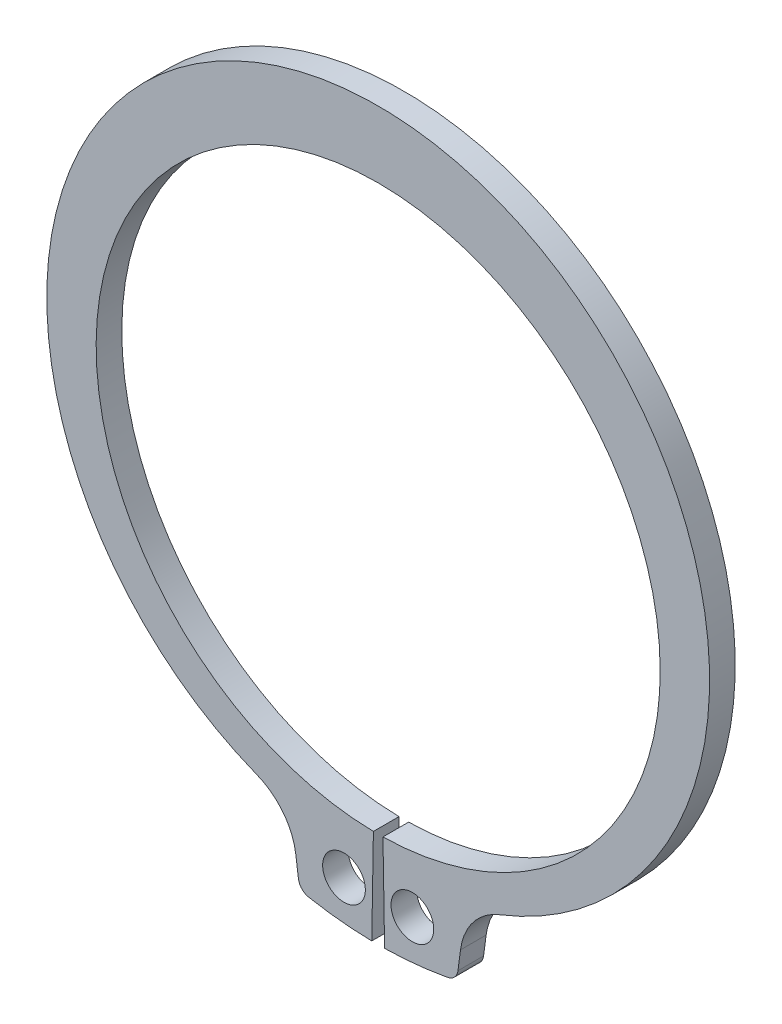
SolidWorks part; units mm, degrees
ref_plane "Plane1" through (0, 0, 0) normal (0, 0, 1) x (1, 0, 0)
ref_plane "Plane2" through (0, 0, 0) normal (0, 1, 0) x (1, 0, 0)
ref_plane "Plane3" through (0, 0, 0) normal (1, 0, 0) x (0, 0, -1)
sketch "Clipboard" plane through (0, 0, 0) normal (0, 0, 1) x (1, 0, 0)
  line L0 (0, 0) -> (3.9, 0)
  line L1 (0, 0) -> (0, 1.95)
  line L2 (0, 0) -> (0, -5.6)
  circle A0 centre (0, 0) radius 1.25
  circle A1 centre (0, 0) radius 17.5
  dimension "HoleDia" = 2.5
  dimension "ShaftDia" = 35
  dimension "LargeSection" = 3.9
  dimension "SmallSection" = 1.95
  dimension "LugSection" = 5.6
sketch "BodySke" plane through (0, 0, 0) normal (0, 0, 1) x (1, 0, 0)
  line L0 (-1.5431, 0) -> (1.5431, 0) construction
  line L1 (0, 0) -> (0, 20.4) construction
  line L2 (0.28, -16.4976) -> (0.375, -22.0968)
  line L3 (-0.28, -16.4976) -> (-0.375, -22.0968)
  line L4 (0, 0) -> (8.4342, -20.4273) construction
  line L5 (0, 0) -> (-8.4342, -20.4273) construction
  line L7 (4.816, -19.9509) -> (4.6668, -21.0843)
  line L8 (-4.816, -19.9509) -> (-4.6668, -21.0843)
  circle A0 centre (0, 0) radius 16.5 construction
  arc A1 (0.28, -16.4976) -> (-0.28, -16.4976) centre (0, 0) ccw
  arc A2 (7.0412, -17.0535) -> (-7.0412, -17.0535) centre (0, 1.0114) ccw construction
  arc A3 (0.375, -22.0968) -> (4.0611, -21.7237) centre (0, 0) ccw
  arc A4 (7.0982, -17.0313) -> (4.816, -19.9509) centre (8.4342, -20.4273) ccw
  arc A5 (-4.816, -19.9509) -> (-7.0982, -17.0313) centre (-8.4342, -20.4273) ccw
  arc A6 (-4.0611, -21.7237) -> (-0.375, -22.0968) centre (0, 0) ccw
  arc A7 (7.0982, -17.0313) -> (-7.0982, -17.0313) centre (0, 1.0114) ccw
  arc A8 (-4.9176, -19.1796) -> (4.9176, -19.1796) centre (0, 0) ccw construction
  circle A9 centre (2, -19.6987) radius 1.25
  circle A10 centre (-2, -19.6987) radius 1.25
  arc A11 (4.6668, -21.0843) -> (4.0611, -21.7237) centre (3.9232, -20.9864) cw
  arc A12 (-4.6668, -21.0843) -> (-4.0611, -21.7237) centre (-3.9232, -20.9864) ccw
  point P28 (4.5968, -21.6167)
  point P31 (-4.5968, -21.6167)
  dimension "GrooveDia" = 33
  dimension "D3" = 0.75
  dimension "LugRad" = 22.1
  dimension "HoleOffsetRad" = 19.8
  dimension "HoleDia" = 2.5
  dimension "D2" = 15
  dimension "LargeRad" = 20.4
  dimension "SmallRad" = 18.45
  dimension "Gap" = 0.75
  dimension "SmallAngle" = 44.87
  dimension "HoleSpacing" = 4
extrude "Body" add sketch "BodySke" against normal blind 1.5
sketch "NotSke" plane through (0, 0, 0) normal (0, 0, 1) x (1, 0, 0)
  line L0 (2, -18.4487) -> (2, -20.9487)
  line L1 (2, -20.9487) -> (-2, -20.9487)
  line L2 (-2, -20.9487) -> (-2, -18.4487)
  line L3 (-2, -18.4487) -> (2, -18.4487)
  circle A0 centre (2, -19.6987) radius 1.25 construction
  circle A1 centre (-2, -19.6987) radius 1.25 construction
extrude "Notch" [suppressed] cut sketch "NotSke" against normal through all
sketch "UnlSke" plane through (0, 0, 0) normal (0, 0, 1) x (1, 0, 0)
  line L0 (-3.6159, -21.8022) -> (-2.6997, -16.2776)
  line L1 (3.6159, -21.8022) -> (2.6997, -16.2776)
  arc A0 (2.6997, -16.2776) -> (-2.6997, -16.2776) centre (0, 0) ccw
  arc A1 (3.6159, -21.8022) -> (-3.6159, -21.8022) centre (0, 0) ccw
  arc A2 (0.375, -22.0968) -> (4.0611, -21.7237) centre (0, 0) ccw construction
  arc A3 (0.28, -16.4976) -> (-0.28, -16.4976) centre (0, 0) ccw construction
  circle A4 centre (-2, -19.6987) radius 1.25 construction
  circle A5 centre (2, -19.6987) radius 1.25 construction
extrude "Unlug" [suppressed] add sketch "UnlSke" against normal through all
equation "' \"ShaftDia@Clipboard\" = 3"
equation "' \"Thickness@Body\" = 0.4"
equation "' \"GrooveDia@BodySke\" = 2.8"
equation "' \"LugSection@Clipboard\" = 1.9"
equation "' \"LargeSection@Clipboard\" = 0.8"
equation "' \"HoleDia@Clipboard\" = 1.0"
equation "' \"ShaftDia@Clipboard\" = 10"
equation "' \"Thickness@Body\" = 1.0"
equation "' \"GrooveDia@BodySke\" = 9.6"
equation "' \"LugSection@Clipboard\" = 3.3"
equation "' \"LargeSection@Clipboard\" = 1.8"
equation "' \"HoleDia@Clipboard\" = 1.5"
equation "\"SmallSection@Clipboard\" = \"LargeSection@Clipboard\" * 0.5"
equation "\"Gap@BodySke\" =  \"Thickness@Body\" / 2"
equation "\"LargeRad@BodySke\" =  \"GrooveDia@BodySke\" / 2 +  \"LargeSection@Clipboard\""
equation "\"SmallRad@BodySke\" =  \"GrooveDia@BodySke\" / 2 +  \"SmallSection@Clipboard\""
equation "\"LugRad@BodySke\" = \"GrooveDia@BodySke\" / 2 + \"LugSection@Clipboard\""
equation "\"HoleOffsetRad@BodySke\" = (  \"ShaftDia@Clipboard\" / 2 + \"LugRad@BodySke\" ) / 2"
equation "\"HoleSpacing@BodySke\" = \"Gap@BodySke\"  * 2 +  \"HoleDia@Clipboard\""
equation "\"HoleDia@BodySke\" =  \"HoleDia@Clipboard\""
equation "\"SmallAngle@BodySke\" = atn(\"HoleSpacing@BodySke\" / 2 / sqr(\"HoleOffsetRad@BodySke\"  * \"HoleOffsetRad@BodySke\" - (\"HoleSpacing@BodySke\" / 2) * (\"HoleSpacing@BodySke\" / 2) ))  * 7 *  (\"LargeRad@BodySke\""
